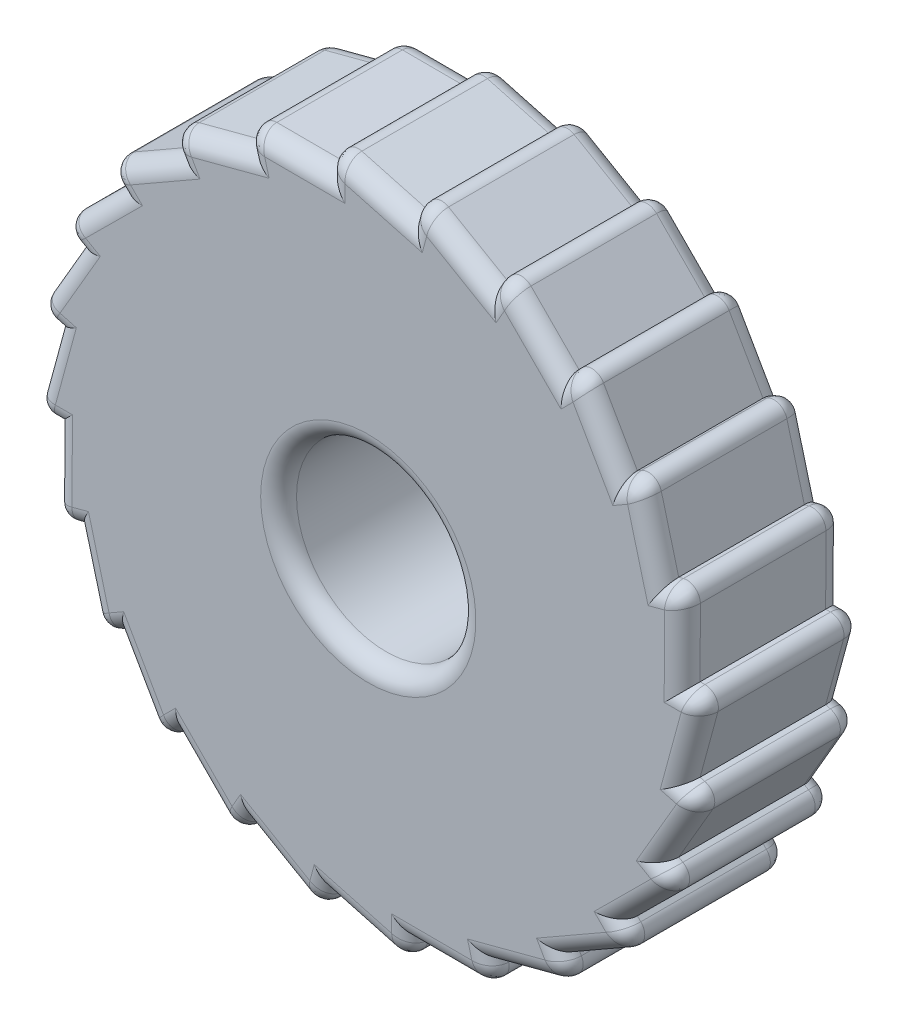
SolidWorks part; units mm, degrees
ref_plane "Front Plane" through (0, 0, 0) normal (0, 0, 1) x (1, 0, 0)
ref_plane "Top Plane" through (0, 0, 0) normal (0, 1, 0) x (1, 0, 0)
ref_plane "Right Plane" through (0, 0, 0) normal (1, 0, 0) x (0, 0, -1)
body saved out of another part "Stock-V1-1"
